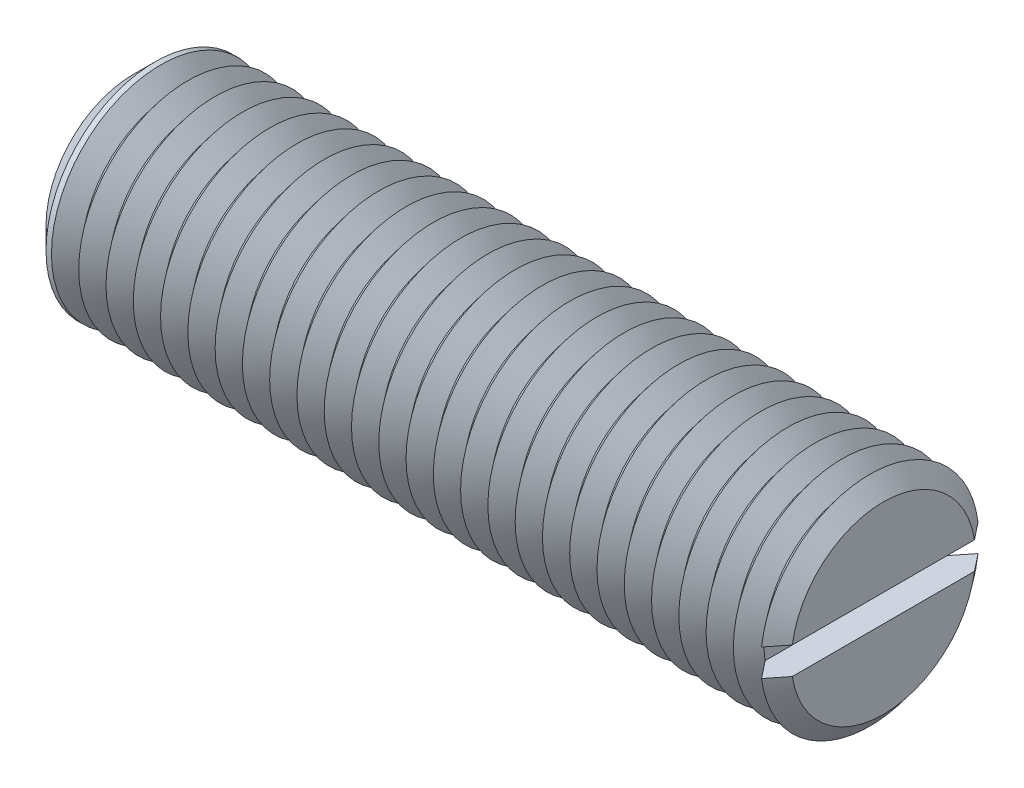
SolidWorks part; units mm, degrees
ref_plane "Front Plane" through (0, 0, 0) normal (0, 0, 1) x (1, 0, 0)
ref_plane "Top Plane" through (0, 0, 0) normal (0, 1, 0) x (1, 0, 0)
ref_plane "Right Plane" through (0, 0, 0) normal (1, 0, 0) x (0, 0, -1)
sketch "Sketch1" plane through (0, 0, 0) normal (1, 0, 0) x (0, 0, -1)
  circle A0 centre (0, 0) radius 8
  dimension "D1" = 16
extrude "Extrude1" add sketch "Sketch1" along normal mid plane 55
sketch "Sketch2" plane through (0, 0, 0) normal (0, 0, 1) x (1, 0, 0)
  line L0 (27.5, 1) -> (25.5, 1)
  line L1 (27.5, -8) -> (27.5, 8) construction
  line L2 (25.5, 1) -> (25.5, -1)
  line L3 (0, 0) -> (50000, 0) construction
  line L4 (27.5, -1) -> (25.5, -1)
  line L5 (27.5, -1) -> (27.5, 1)
  point P9 (25.5, 0)
  dimension "D1" = 2
extrude "Extrude2" cut sketch "Sketch2" against normal mid plane 24
chamfer "Chamfer1" distance 1.6 angle 45 1 edges at (-27.5, 0, -8)
sketch "Sketch3" plane through (0, 0, 0) normal (0, 0, 1) x (1, 0, 0)
  line L0 (0, 0) -> (30.9602, 0) construction
  line L1 (26.5, -8) -> (28.5, -8)
  line L2 (-25.9, -8) -> (27.5, -8) construction
  line L3 (28.5, -8) -> (27.5, -6.751)
  line L4 (27.5, -8) -> (27.5, -1) construction
  line L5 (27.5, -6.751) -> (26.5, -8)
  dimension "D1" = 2
  dimension "D2" = 1.6
revolve "Cut-Revolve1" cut sketch "Sketch3" angle 360 about L0
pattern_linear "LPattern1" count 27 spacing 2 along (-1, 0, 0) of "Cut-Revolve1"
equation "\"D2@Sketch3\" = \"D1@Sketch3\"*0.8"
